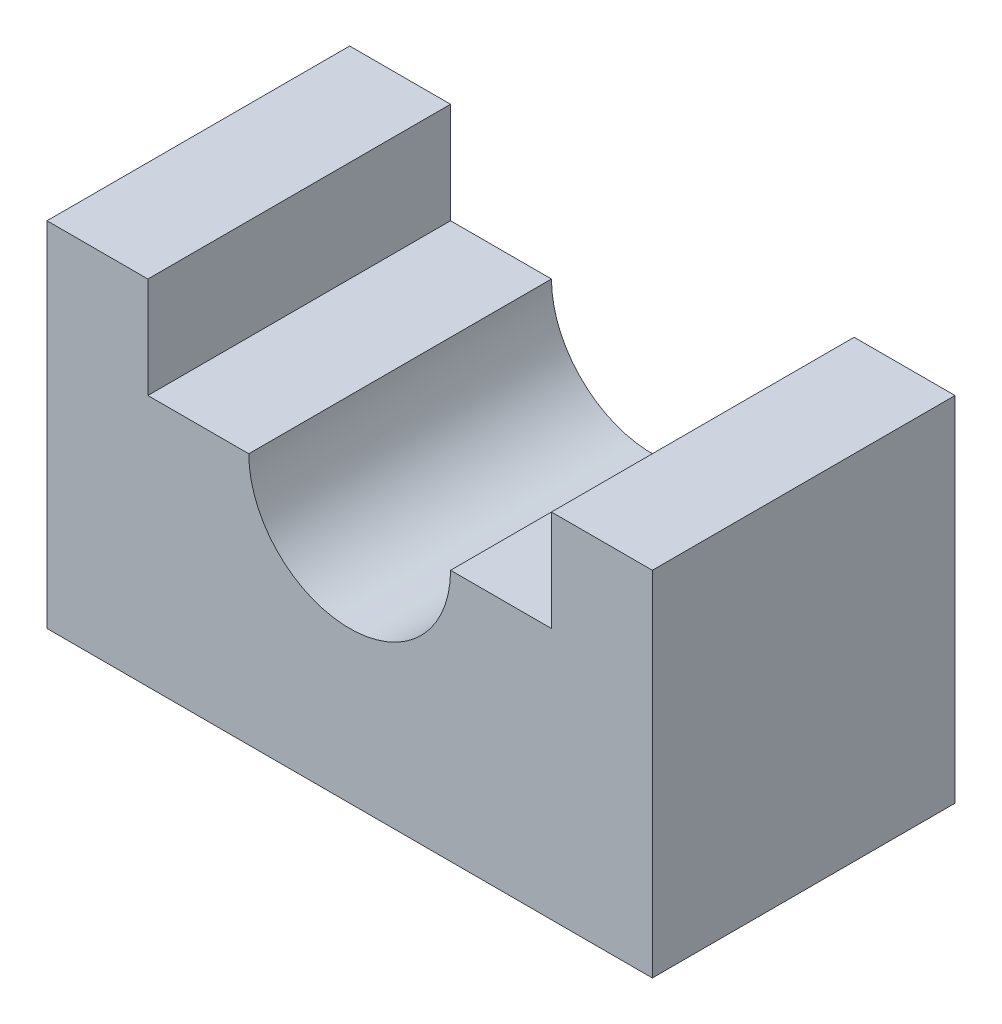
SolidWorks part; units mm, degrees
ref_plane "Front Plane" through (0, 0, 0) normal (0, 0, 1) x (1, 0, 0)
ref_plane "Top Plane" through (0, 0, 0) normal (0, 1, 0) x (1, 0, 0)
ref_plane "Right Plane" through (0, 0, 0) normal (1, 0, 0) x (0, 0, -1)
sketch "Sketch1" plane through (0, 0, 0) normal (0, 0, 1) x (1, 0, 0)
  line L0 (30, 0) -> (90, 0)
  line L1 (90, 0) -> (90, 35)
  line L2 (90, 35) -> (80, 35)
  line L3 (80, 35) -> (80, 25)
  line L4 (80, 25) -> (70, 25)
  line L5 (50, 25) -> (40, 25)
  line L6 (40, 25) -> (40, 35)
  line L7 (40, 35) -> (30, 35)
  line L8 (30, 35) -> (30, 0)
  arc A0 (70, 25) -> (50, 25) centre (60, 25) cw
  dimension "D3" = 10
  dimension "D1" = 60
  dimension "D2" = 35
  dimension "D4" = 10
  dimension "D5" = 10
  dimension "D6" = 30
  dimension "D7" = 10
extrude "Extrude1" add sketch "Sketch1" along normal mid plane 30
